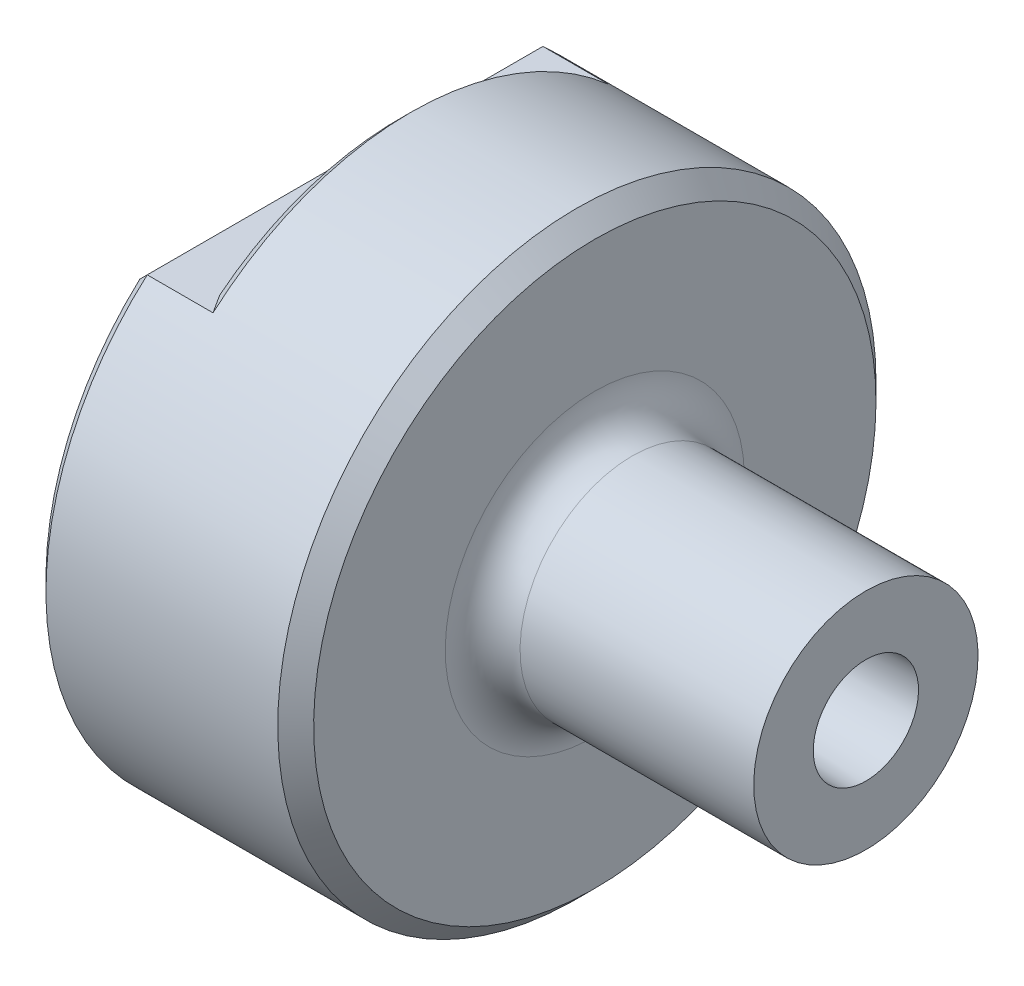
SolidWorks part; units mm, degrees
ref_plane "Front Plane" through (0, 0, 0) normal (0, 0, 1) x (1, 0, 0)
ref_plane "Top Plane" through (0, 0, 0) normal (0, 1, 0) x (1, 0, 0)
ref_plane "Right Plane" through (0, 0, 0) normal (1, 0, 0) x (0, 0, -1)
sketch "Sketch1" plane through (0, 0, 0) normal (1, 0, 0) x (0, 0, -1)
  circle A0 centre (0, 0) radius 25.4
  dimension "Rod Dia" = 50.8
extrude "Boss-Extrude1" add sketch "Sketch1" along normal mid plane 45.2437 contours A0
sketch "Sketch3" plane through (-22.6219, 0, 0) normal (-1, 0, 0) x (0, 0, 1)
  line L1 (-25.4, 25.4) -> (25.4, 25.4)
  line L2 (-25.4, 25.4) -> (-25.4, 19.05)
  line L3 (-25.4, 19.05) -> (25.4, 19.05)
  line L4 (25.4, 25.4) -> (25.4, 19.05)
  line L5 (-25.4, 25.4) -> (25.4, 19.05) construction
  line L6 (-25.4, 19.05) -> (25.4, 25.4) construction
  circle A0 centre (0, 0) radius 25.4 construction
  point P0 (0, 22.225)
  dimension "D1" = 19.05
extrude "Cut-Extrude1" cut sketch "Sketch3" against normal blind 5.588
sketch "Sketch5" plane through (0, 0, 0) normal (0, 0, 1) x (1, 0, 0)
  line L0 (22.6219, 0) -> (-22.6219, 0) construction
  line L1 (22.6219, -25.4) -> (22.6219, 25.4) construction
  line L2 (-22.6219, 19.05) -> (-22.6219, -25.4) construction
  line L3 (-0.3969, -9.525) -> (22.6219, -9.525)
  line L4 (22.6219, -9.525) -> (22.6219, -25.4)
  line L5 (22.6219, -25.4) -> (-0.3969, -25.4)
  line L6 (-22.6219, -25.4) -> (22.6219, -25.4) construction
  line L7 (-0.3969, -25.4) -> (-0.3969, -9.525)
  dimension "B" = 22.225
  dimension "D" = 19.05
revolve "Cut-Revolve1" cut sketch "Sketch5" angle 360 about L0
sketch "Sketch6" plane through (0, 0, 0) normal (0, 0, 1) x (1, 0, 0)
  line L0 (22.6219, 0) -> (-22.6219, 0) construction
  line L1 (22.6219, -9.525) -> (22.6219, 9.525) construction
  line L2 (-22.6219, 19.05) -> (-22.6219, -25.4) construction
  line L3 (-17.9991, 0) -> (-22.6219, 0)
  line L5 (-22.6219, 9.8005) -> (-22.6219, 0)
  arc A0 (-22.6219, 9.8005) -> (-17.9991, 0) centre (-30.6991, 0) cw
  dimension "D1" = 12.7
  dimension "D2" = 4.6228
revolve "Cut-Revolve2" cut sketch "Sketch6" angle 360 about L0
sketch "Sketch7" plane through (0, 0, 0) normal (0, 0, 1) x (1, 0, 0)
  line L0 (-18.5117, 3.5719) -> (22.6219, 4.4694)
  line L2 (22.6219, -9.525) -> (22.6219, 9.525) construction
  line L3 (-18.5117, 0) -> (22.6219, 0)
  line L4 (22.6219, 0) -> (-22.6219, 0) construction
  line L5 (-22.6219, 19.05) -> (-22.6219, -25.4) construction
  line L6 (22.6219, 4.4694) -> (22.6219, 0)
  line L7 (-18.5117, 3.5719) -> (-18.5117, 0)
  line L8 (22.6219, 0) -> (41.1743, 0.1051)
  arc A1 (-22.6219, -9.8005) -> (-22.6219, 9.8005) centre (-30.6991, 0) ccw construction
  dimension "D1" = 1.25
  dimension "D2" = 7.1437
revolve "Cut-Revolve3" cut sketch "Sketch7" angle 360 about L4
fillet "Fillet1" radius 3.175 1 edges at (-0.3969, 9.525, 0)
chamfer "Chamfer1" distance 1.524 angle 45 1 edges at (-0.3969, 25.4, 0)
chamfer "Chamfer2" distance 1.016 angle 45 3 edges at (-17.0339, 25.4, 0) (-22.6219, -25.4, 0) (-22.6219, 19.05, 0)
